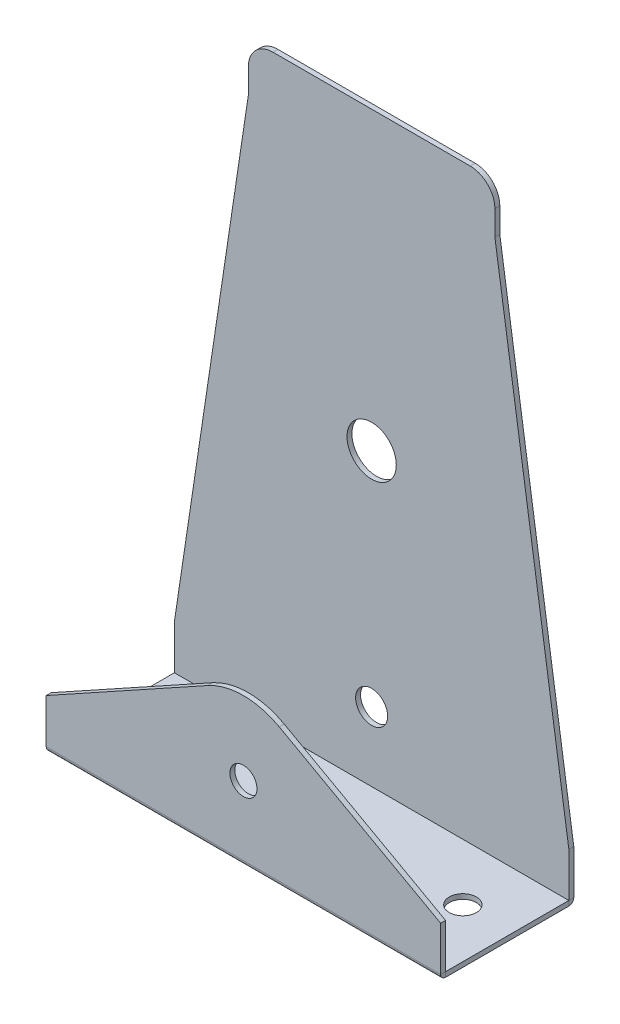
SolidWorks part; units mm, degrees
ref_plane "Front Plane" through (0, 0, 0) normal (0, 0, 1) x (1, 0, 0)
ref_plane "Top Plane" through (0, 0, 0) normal (0, 1, 0) x (1, 0, 0)
ref_plane "Right Plane" through (0, 0, 0) normal (1, 0, 0) x (0, 0, -1)
sketch "Sketch1" plane through (0, 0, 0) normal (0, 0, 1) x (1, 0, 0)
  line L0 (0, 0) -> (0, 202.8661) construction
  line L1 (-40, 5) -> (40, 5) construction
  line L2 (-40, 15) -> (40, 15) construction
  line L3 (40, 5) -> (40, 48)
  line L4 (-40, 5) -> (-40, 48)
  line L5 (40, 0) -> (40, 110.5362) construction
  line L6 (-40, 0) -> (-40, 110.5362) construction
  line L7 (40, 5) -> (7.2654, -13.123)
  line L8 (-40, 5) -> (-7.2654, -13.123)
  line L9 (-40, 40) -> (40, 40) construction
  line L10 (-40, 48) -> (40, 48) construction
  line L11 (0, 0) -> (0, 110.5362) construction
  line L12 (-20, 158) -> (20, 158)
  line L13 (-25, 158) -> (25, 158) construction
  line L14 (-25, 148) -> (-25, 153)
  line L15 (-25, 148) -> (-40, 48)
  line L16 (-25, 0) -> (-25, 202.8661) construction
  line L17 (-25, 148) -> (25, 148) construction
  line L18 (25, 148) -> (25, 153)
  line L19 (25, 148) -> (40, 48)
  line L20 (-40, 27.5) -> (40, 27.5) construction
  circle A0 centre (0, 0) radius 2.75
  arc A1 (-7.2654, -13.123) -> (7.2654, -13.123) centre (0, 0) ccw
  circle A2 centre (0, 98) radius 5
  arc A3 (25, 153) -> (20, 158) centre (20, 153) ccw
  arc A4 (-25, 153) -> (-20, 158) centre (-20, 153) cw
  circle A5 centre (-30, 27.5) radius 2.75
  circle A6 centre (30, 27.5) radius 2.75
  circle A7 centre (0, 53) radius 3.25
  dimension "D1" = 5.5
  dimension "D2" = 15
  dimension "D4" = 15
  dimension "D10" = 10
  dimension "D15" = 5
  dimension "D16" = 5.5
  dimension "D17" = 60
  dimension "D18" = 30
  dimension "D20" = 6.5
  dimension "D21" = 13
  dimension "D3" = 10
  dimension "D9" = 58
  dimension "D11" = 118
  dimension "D12" = 25
  dimension "D22" = 12.5
  dimension "D5" = 40
  dimension "D6" = 40
  dimension "D7" = 25
  dimension "D8" = 8
  dimension "D13" = 25
  dimension "D14" = 10
sheet metal parameters "Sheet-Metal1" thickness 1 parameters "D1"=0.0001
base flange "Base-Flange1" sketch "Sketch1" thickness 1 reverse thickness direction yes parameters "D1"=0.0001
sketch "Sketch3" plane through (0, 0, 1) normal (0, 0, 1) x (1, 0, 0)
  line L0 (-40, 14) -> (40, 14)
  line L1 (-40, 48) -> (-40, 5) construction
  line L2 (40, 5) -> (40, 48) construction
  line L3 (40, 39) -> (-40, 39)
  dimension "D1" = 25
  dimension "D2" = 9
sketched bend "Sketched Bend1" parameters "D1"=0
bend "SketchBend1" bend radius 0.0001 bend angle 90 parameters "D5"=1
bend "SketchBend2" bend radius 0 bend angle 90 parameters "D5"=2
flat pattern "Flat-Pattern1"
sketch "Bend-Lines1" plane through (0, 0, 0) normal (0, 1, 0) x (-1, 0, 0)
bend of the flat pattern "Flatten-<SketchBend1>1"
bend of the flat pattern "Flatten-<SketchBend2>1"
